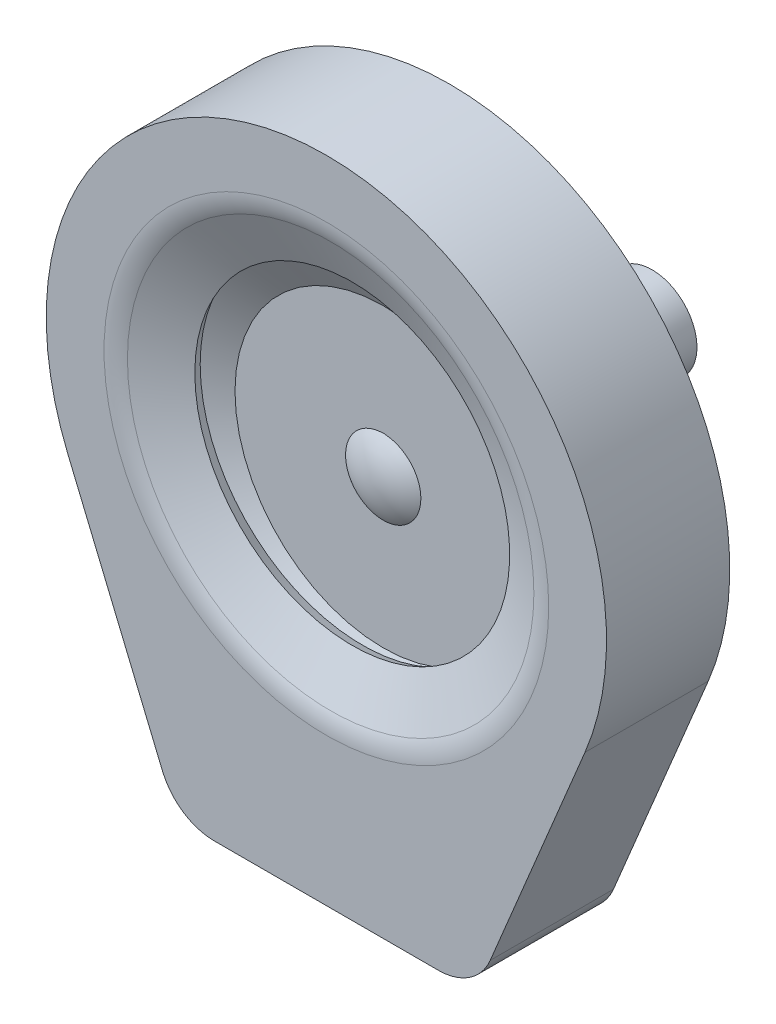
SolidWorks part; units mm, degrees
ref_plane "Front" through (0, 0, 0) normal (0, 0, 1) x (1, 0, 0)
ref_plane "Top" through (0, 0, 0) normal (0, 1, 0) x (1, 0, 0)
ref_plane "Right" through (0, 0, 0) normal (1, 0, 0) x (0, 0, -1)
sketch "Sketch1" plane through (0, 0, 0) normal (1, 0, 0) x (0, 0, -1)
  line L0 (0, 0) -> (-5.9446, 0) construction
  line L1 (0, 0) -> (12, 0)
  line L3 (12, 0) -> (12, 2)
  line L4 (12, 2) -> (3, 2)
  line L5 (3, 2) -> (3, 10)
  line L6 (3, 10) -> (0, 10)
  line L7 (0, 10) -> (0, 0)
  dimension "D1" = 4
  dimension "D2" = 10
  dimension "D3" = 3
  dimension "D4" = 12
revolve "Revolve1" add sketch "Sketch1" angle 360 about L0
sketch "Sketch2" plane through (0, 0, 0) normal (1, 0, 0) x (0, 0, -1)
  line L0 (0, 0) -> (-2.779, 0) construction
  line L1 (0, 0) -> (-5.9446, 0) construction
  line L2 (0, 2.779) -> (-3.5917, 9)
  line L3 (0, 10) -> (0, -10) construction
  line L4 (-3.5917, 9) -> (-3.5917, 11)
  line L5 (3, 10) -> (0, 10) construction
  arc A0 (-2.779, 0) -> (0, 2.779) centre (0, 0) cw
  dimension "D1" = 30
  dimension "D2" = 1
  dimension "D3" = 2
revolve "Revolve-Thin2" add sketch "Sketch2" angle 360 about L0
sketch "Sketch4" plane through (0, 0, 0) normal (0, 0, 1) x (1, 0, 0)
  line L0 (0, 0) -> (0, -16) construction
  line L1 (-5.0019, -16) -> (5.0019, -16)
  line L2 (6.8481, -14.7689) -> (11.0776, -4.6137)
  line L3 (-6.8481, -14.7689) -> (-11.0776, -4.6137)
  arc A1 (-6.8481, -14.7689) -> (-5.0019, -16) centre (-5.0019, -14) ccw
  circle A2 centre (0, 0) radius 12
  arc A3 (11.0776, -4.6137) -> (-11.0776, -4.6137) centre (0, 0) ccw
  arc A4 (5.0019, -16) -> (6.8481, -14.7689) centre (5.0019, -14) ccw
  point P9 (-6.3354, -16)
  point P12 (6.3354, -16)
  dimension "D2" = 16
  dimension "D4" = 2
  dimension "D1" = 1
extrude "Extrude-Thin1" add sketch "Sketch4" along normal blind 5 thin
sketch "Sketch5" plane through (0, 0, 5) normal (0, 0, 1) x (1, 0, 0)
  line L3 (-11.5392, -4.8059) -> (-7.3097, -14.9612)
  line L4 (-5.0019, -16.5) -> (5.0019, -16.5)
  line L5 (7.3097, -14.9612) -> (11.5392, -4.8059)
  line L6 (-11.5392, -4.8059) -> (-7.3097, -14.9612)
  line L7 (-5.0019, -16.5) -> (5.0019, -16.5)
  line L8 (7.3097, -14.9612) -> (11.5392, -4.8059)
  arc A3 (11.5392, -4.8059) -> (-11.5392, -4.8059) centre (0, 0) ccw
  arc A4 (-7.3097, -14.9612) -> (-5.0019, -16.5) centre (-5.0019, -14) ccw
  arc A5 (5.0019, -16.5) -> (7.3097, -14.9612) centre (5.0019, -14) ccw
  arc A6 (11.5392, -4.8059) -> (-11.5392, -4.8059) centre (0, 0) ccw
  arc A7 (-7.3097, -14.9612) -> (-5.0019, -16.5) centre (-5.0019, -14) ccw
  arc A8 (5.0019, -16.5) -> (7.3097, -14.9612) centre (5.0019, -14) ccw
  circle A9 centre (0, 0) radius 9.9732
  circle A10 centre (0, 0) radius 9.9732
  dimension "D1" = 0
  dimension "D2" = 1
extrude "Extrude1" add sketch "Sketch5" along normal blind 0.5
sketch "Sketch6" plane through (0, 0, 0) normal (1, 0, 0) x (0, 0, -1)
  line L0 (-5.5, 9.9732) -> (-5.5, 9.4732)
  line L1 (-5.5, 12.5) -> (-5.5, -4.8059) construction
  line L2 (-5.5, 9.4732) -> (-4.3454, 7.0247)
  line L3 (0, 0) -> (-2.0776, 0) construction
  line L4 (0, 0) -> (-5.9446, 0) construction
  dimension "D1" = 0.5
revolve "Revolve-Thin3" add sketch "Sketch6" angle 360 about L3
fillet "Fillet1" radius 2 1 edges at (-9.4732, 0, 5.5)
scale "Scale1" bodies to scale 105 102 101 scale about centroid uniform scaling yes scale factor 2
